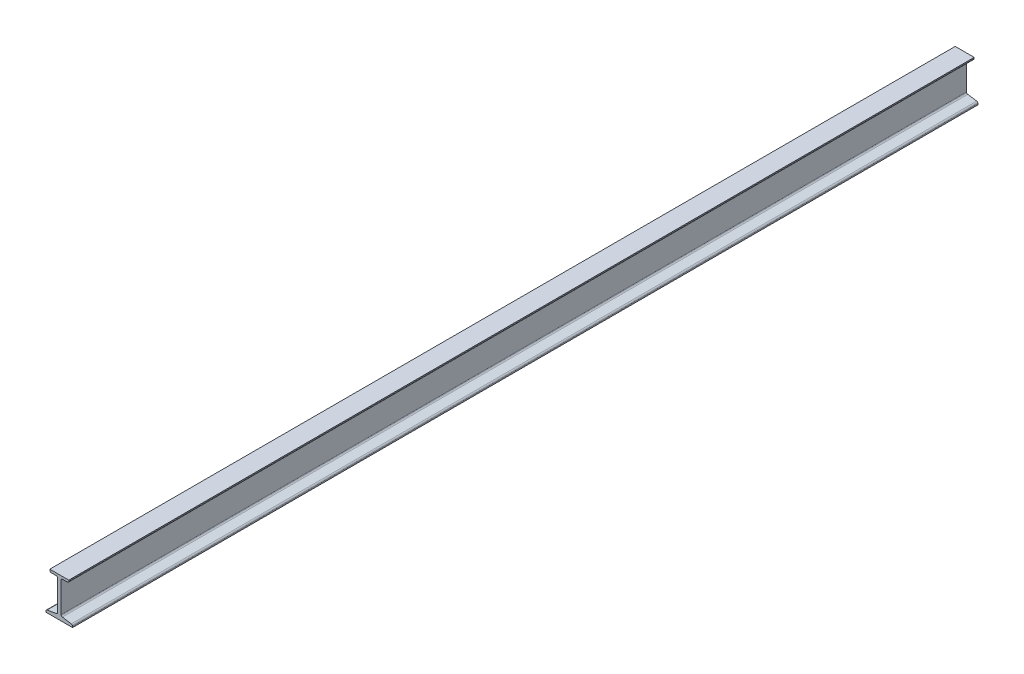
SolidWorks part; units mm, degrees
ref_plane "Face" through (0, 0, 0) normal (0, 0, 1) x (1, 0, 0)
ref_plane "Dessus" through (0, 0, 0) normal (0, 1, 0) x (1, 0, 0)
ref_plane "Droite" through (0, 0, 0) normal (1, 0, 0) x (0, 0, -1)
sketch "Esquisse1" plane through (0, 0, 0) normal (0, 0, 1) x (1, 0, 0)
  line L0 (-44, -40.7781) -> (44, -40.7781)
  line L1 (44, -40.7781) -> (44, -37.0485)
  line L2 (39.7822, -32.11) -> (10.2178, -27.4275)
  line L3 (6, -22.489) -> (6, 76.2219)
  line L4 (11, 81.2219) -> (26.5, 81.2219)
  line L5 (31.5, 86.2219) -> (31.5, 89.2219)
  line L6 (0, -7.4482) -> (0, 88.9755) construction
  line L7 (-31.5, 86.2219) -> (-31.5, 89.2219)
  line L8 (-11, 81.2219) -> (-26.5, 81.2219)
  line L9 (-6, -22.489) -> (-6, 76.2219)
  line L10 (-39.7822, -32.11) -> (-10.2178, -27.4275)
  line L11 (-44, -40.7781) -> (-44, -37.0485)
  line L12 (-31.5, 89.2219) -> (31.5, 89.2219)
  arc A1 (6, 76.2219) -> (11, 81.2219) centre (11, 76.2219) cw
  arc A2 (10.2178, -27.4275) -> (6, -22.489) centre (11, -22.489) cw
  arc A3 (44, -37.0485) -> (39.7822, -32.11) centre (39, -37.0485) ccw
  arc A4 (26.5, 81.2219) -> (31.5, 86.2219) centre (26.5, 86.2219) ccw
  arc A5 (-26.5, 81.2219) -> (-31.5, 86.2219) centre (-26.5, 86.2219) cw
  arc A6 (-44, -37.0485) -> (-39.7822, -32.11) centre (-39, -37.0485) cw
  arc A7 (-10.2178, -27.4275) -> (-6, -22.489) centre (-11, -22.489) ccw
  arc A8 (-6, 76.2219) -> (-11, 81.2219) centre (-11, 76.2219) ccw
  point P18 (44, -32.7781)
  point P36 (0, -40.7781)
  dimension "D7" = 5
  dimension "D1" = 63
  dimension "D2" = 8
  dimension "D3" = 130
  dimension "D4" = 12
  dimension "D5" = 99
  dimension "D6" = 8
  dimension "D8" = 88
extrude "Extrusion1" add sketch "Esquisse1" along normal blind 3000
